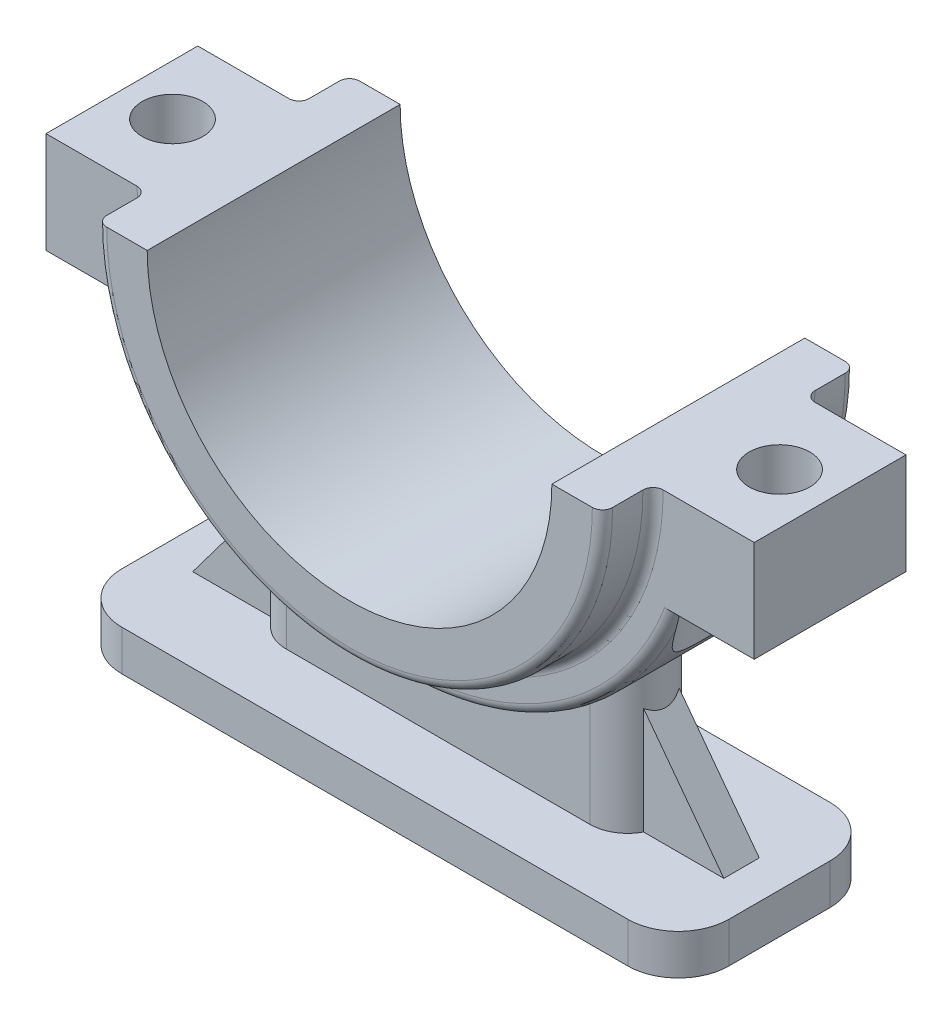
SolidWorks part; units mm, degrees
ref_plane "Płaszczyzna przednia" through (0, 0, 0) normal (0, 0, 1) x (1, 0, 0)
ref_plane "Płaszczyzna górna" through (0, 0, 0) normal (0, 1, 0) x (1, 0, 0)
ref_plane "Płaszczyzna prawa" through (0, 0, 0) normal (1, 0, 0) x (0, 0, -1)
sketch "Szkic1" plane through (0, 0, 0) normal (0, 0, 1) x (1, 0, 0)
  line L0 (40, 0) -> (70, 0)
  line L1 (-70, 0) -> (-40, 0)
  line L2 (-70, 0) -> (-70, -20)
  line L3 (-70, -20) -> (-54.4426, -20)
  line L4 (70, 0) -> (70, -20)
  line L5 (54.4426, -20) -> (70, -20)
  arc A0 (-54.4426, -20) -> (54.4426, -20) centre (0, 0) ccw
  arc A1 (-40, 0) -> (40, 0) centre (0, 0) ccw
  dimension "D3" = 40
  dimension "D4" = 58
  dimension "D1" = 140
  dimension "D2" = 20
extrude "Wyciągnięcie1" add sketch "Szkic1" along normal mid plane 30
sketch "Szkic2" plane through (0, 0, 0) normal (0, 0, 1) x (1, 0, 0)
  line L0 (70, 0) -> (40, 0) construction
  line L1 (-40, 0) -> (-70, 0) construction
  line L2 (-50, 0) -> (-40, 0)
  line L3 (40, 0) -> (50, 0)
  arc A0 (-40, 0) -> (40, 0) centre (0, 0) ccw construction
  arc A1 (-40, 0) -> (40, 0) centre (0, 0) ccw
  arc A2 (50, 0) -> (-50, 0) centre (0, 0) cw
  dimension "D1" = 50
extrude "Wyciągnięcie2" add sketch "Szkic2" along normal mid plane 50
sketch "Szkic3" plane through (0, -20, 0) normal (0, -1, 0) x (1, 0, 0)
  line L0 (0, 0) -> (0, 25) construction
  line L1 (50, 25) -> (-50, 25) construction
  circle A0 centre (-60, 0) radius 6
  dimension "D2" = 12
  dimension "D1" = 120
extrude "Wyciągnięcie3" cut sketch "Szkic3" against normal through all
sketch "Szkic4" plane through (0, -20, 0) normal (0, -1, 0) x (1, 0, 0)
  circle A0 centre (-60, 0) radius 15
  dimension "D1" = 15
extrude "Wyciągnięcie4" cut sketch "Szkic4" along normal through all
mirror "Lustro1" about plane through (0, 0, 0) normal (1, 0, 0) of "Wyciągnięcie3", "Wyciągnięcie4"
fillet "Zaokrąglenie1" radius 2 6 edges at (0, -50, 25) (0, -50, 15) (0, -58, 15) (0, -58, -15) (0, -50, -15) (0, -50, -25)
sketch "Szkic5" plane through (0, 0, 0) normal (0, 0, 1) x (1, 0, 0)
  line L0 (70, 0) -> (52, 0) construction
  line L1 (60, -80) -> (-60, -80)
  line L2 (60, -80) -> (60, -72)
  line L3 (60, -72) -> (-60, -72)
  line L4 (-60, -80) -> (-60, -72)
  line L5 (60, -80) -> (-60, -72) construction
  line L6 (60, -72) -> (-60, -80) construction
  point P0 (0, -76)
  dimension "D1" = 120
  dimension "D2" = 8
  dimension "D3" = 80
extrude "Dodanie-wyciągnięcie1" add sketch "Szkic5" along normal mid plane 40 separate body
sketch "Szkic6" plane through (0, -72, 0) normal (0, 1, 0) x (1, 0, 0)
  line L0 (-30, 0) -> (30, 0) construction
  line L1 (-30, 7.5) -> (30, 7.5)
  line L2 (-30, -7.5) -> (30, -7.5)
  arc A0 (-30, 7.5) -> (-30, -7.5) centre (-30, 0) ccw
  arc A1 (30, -7.5) -> (30, 7.5) centre (30, 0) ccw
  point P2 (0, 0)
  dimension "D2" = 75
  dimension "D1" = 15
extrude "Dodanie-wyciągnięcie2" add sketch "Szkic6" along normal up to next
sketch "Szkic7" plane through (0, 0, 0) normal (0, 0, 1) x (1, 0, 0)
  line L0 (-37.5, -52) -> (-52.5, -72)
  line L1 (-37.5, -44.2465) -> (-37.5, -72) construction
  line L2 (60, -72) -> (-60, -72) construction
  dimension "D1" = 15
  dimension "D2" = 20
rib "Żebro1" sketch "Szkic7" sketch "Szkic7" thickness 7 extrusion direction parallel to sketch draft on no parameters "D1"=7
mirror "Lustro2" about plane through (0, 0, 0) normal (1, 0, 0) of "Żebro1"
fillet "Zaokrąglenie2" radius 10 4 edges at (60, -76, -20) (60, -76, 20) (-60, -76, -20) (-60, -76, 20)
